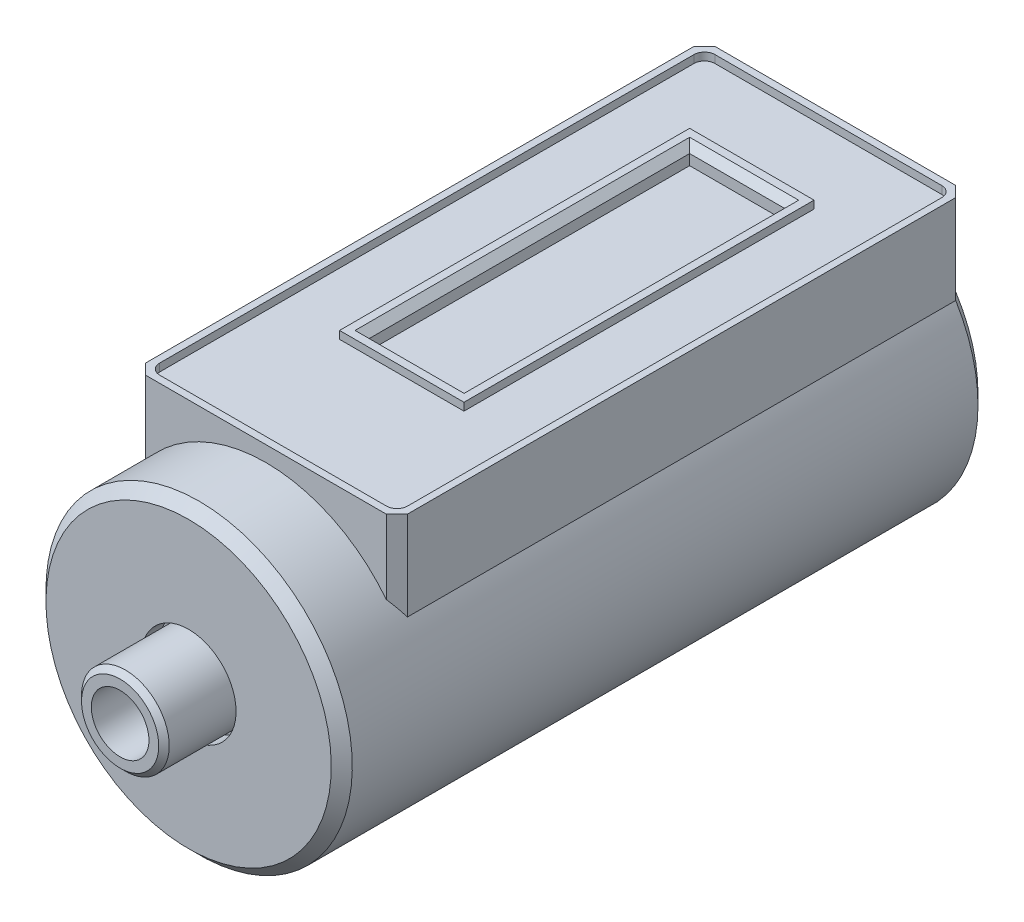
SolidWorks part; units mm, degrees
ref_plane "Front" through (0, 0, 0) normal (0, 0, 1) x (1, 0, 0)
ref_plane "Top" through (0, 0, 0) normal (0, 1, 0) x (1, 0, 0)
ref_plane "Right" through (0, 0, 0) normal (1, 0, 0) x (0, 0, -1)
sketch "Sketch2" plane through (0, 0, 0) normal (1, 0, 0) x (0, 0, -1)
  line L0 (8.635, 0) -> (8.635, 2.79)
  line L1 (9.015, 3.17) -> (14.855, 3.17)
  line L2 (13.585, 3.43) -> (13.585, 10.31)
  line L3 (14.345, 11.07) -> (60.325, 11.07)
  line L4 (60.325, 11.07) -> (60.325, 0)
  line L5 (60.325, 0) -> (8.635, 0)
  line L6 (13.585, 3.43) -> (14.855, 3.43)
  line L7 (14.855, 3.43) -> (14.855, 3.17)
  line L8 (8.635, 2.79) -> (9.015, 3.17)
  line L9 (13.585, 10.31) -> (14.345, 11.07)
  point P5 (0, 0)
  point P12 (0, 0)
  point P13 (20.2453, 0.9866)
  dimension "D1" = 51.69
  dimension "D2" = 3.17
  dimension "D3" = 11.07
  dimension "D4" = 4.95
  dimension "D5" = 1.27
  dimension "D6" = 3.43
  dimension "D7" = 2.79
  dimension "D8" = 0.38
  dimension "D9" = 0.76
  dimension "D10" = 10.31
  dimension "D11" = 60.325
revolve "Revolve1" add sketch "Sketch2" angle 360 about L5
sketch "Sketch3" plane through (0, 0, 0) normal (0, 1, 0) x (1, 0, 0)
  line L0 (11.07, 60.325) -> (-11.07, 60.325) construction
  line L1 (-9.46, 60.325) -> (9.46, 60.325)
  line L2 (-9.46, 60.325) -> (-9.46, 19.935)
  line L3 (-8.7, 19.175) -> (8.7, 19.175)
  line L4 (9.46, 60.325) -> (9.46, 19.935)
  line L5 (-9.46, 19.935) -> (-8.7, 19.175)
  line L6 (9.46, 19.935) -> (8.7, 19.175)
  point P1 (9.46, 19.175)
  point P2 (-9.46, 19.175)
  point P6 (0, 19.175)
  dimension "D1" = 41.15
  dimension "D2" = 18.92
extrude "Extrude1" add sketch "Sketch3" along normal blind 12.19
chamfer "Chamfer1" distance 0.76 angle 45 3 edges at (-9.46, 8.9696, -60.325) (0, -11.07, -60.325) (9.46, 8.9696, -60.325)
sketch "Sketch4" plane through (0, 12.19, 0) normal (0, 1, 0) x (1, 0, 0)
  line L0 (-8.7, 19.175) -> (8.7, 19.175) construction
  line L1 (-8.19, 59.815) -> (8.2, 59.815)
  line L2 (-8.95, 59.055) -> (-8.95, 20.445)
  line L3 (-8.19, 19.685) -> (8.2, 19.685)
  line L4 (8.96, 59.055) -> (8.96, 20.445)
  line L5 (-9.46, 19.935) -> (-9.46, 59.565) construction
  line L7 (-4.49, 54.285) -> (4.5, 54.285)
  line L8 (-4.49, 54.285) -> (-4.49, 28.985)
  line L9 (-4.49, 28.985) -> (4.5, 28.985)
  line L10 (4.5, 54.285) -> (4.5, 28.985)
  arc A0 (-8.95, 59.055) -> (-8.19, 59.815) centre (-8.19, 59.055) cw
  arc A1 (8.96, 59.055) -> (8.2, 59.815) centre (8.2, 59.055) ccw
  arc A2 (8.96, 20.445) -> (8.2, 19.685) centre (8.2, 20.445) cw
  arc A3 (-8.95, 20.445) -> (-8.19, 19.685) centre (-8.19, 20.445) ccw
  dimension "D5" = 0.76
  dimension "D1" = 17.91
  dimension "D2" = 40.13
  dimension "D3" = 0.51
  dimension "D4" = 0.51
  dimension "D6" = 5.53
  dimension "D7" = 4.46
  dimension "D8" = 4.46
  dimension "D9" = 25.3
extrude "Cut-Extrude1" cut sketch "Sketch4" against normal blind 0.56
sketch "Sketch5" plane through (0, 12.19, 0) normal (0, 1, 0) x (1, 0, 0)
  line L1 (-3.42, 53.215) -> (3.44, 53.215)
  line L2 (-3.42, 53.215) -> (-3.42, 30.055)
  line L3 (-3.42, 30.055) -> (3.44, 30.055)
  line L4 (3.44, 53.215) -> (3.44, 30.055)
  line L6 (4.5, 54.285) -> (-4.49, 54.285) construction
  line L7 (-4.49, 54.285) -> (-4.49, 28.985) construction
  point P4 (0.005, 54.285)
  dimension "D1" = 6.86
  dimension "D2" = 23.16
  dimension "D3" = 1.07
  dimension "D4" = 1.07
extrude "Cut-Extrude2" cut sketch "Sketch5" against normal blind 1.27
chamfer "Chamfer2" distance 0.51 angle 45 4 edges at (0.01, 12.19, -30.055) (3.44, 12.19, -41.635) (-3.42, 12.19, -41.635) (0.01, 12.19, -53.215)
hole_wizard "Hole1" positions "Sketch7" profile "Sketch6" legacy
sketch "Sketch7" plane through (0, 0, -8.635) normal (0, 0, 1) x (1, 0, 0)
  circle A0 centre (0, 0) radius 3.17 construction
  point P0 (0, 0)
sketch "Sketch6" plane through (0, 0, -8.635) normal (1, 0, 0) x (0, -1, 0)
  line L0 (0, 0) -> (0, 7.6015)
  line L1 (0, 7.6015) -> (2.0828, 6.35)
  line L2 (2.0828, 6.35) -> (2.0828, 0)
  line L4 (2.0828, 0) -> (0, 0)
  line L6 (0, 7.6015) -> (-2.0828, 6.35) construction
  line L7 (0, -4.2442) -> (0, 117.3081) construction
  dimension "Diameter" = 4.1656
  dimension "Depth" = 6.35
  dimension "Drill Angle" = 118
